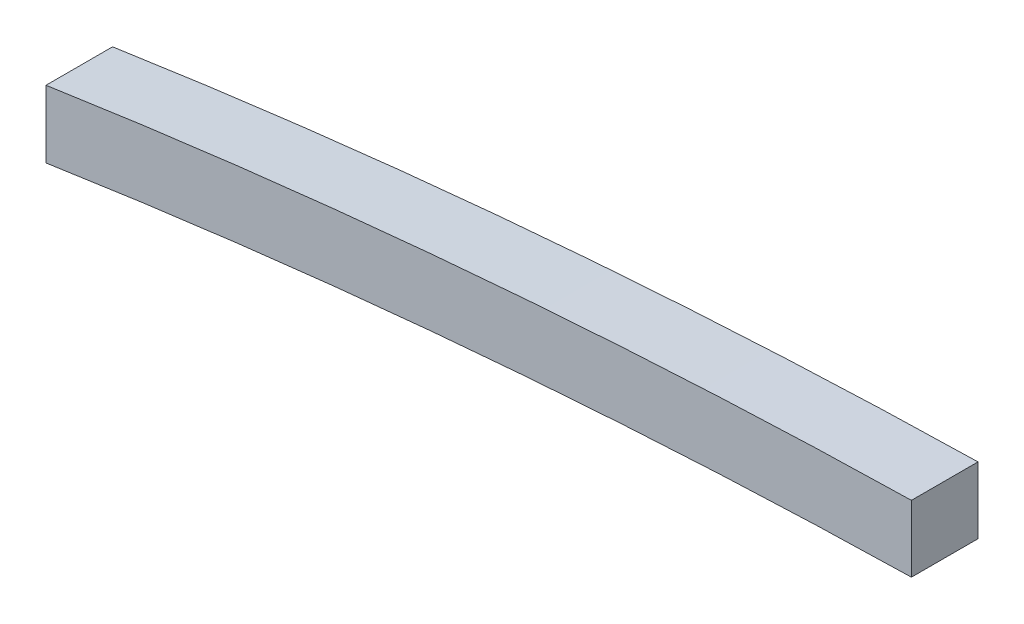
SolidWorks part; units mm, degrees
ref_plane "Ebene vorne" through (0, 0, 0) normal (0, 0, 1) x (1, 0, 0)
ref_plane "Ebene oben" through (0, 0, 0) normal (0, 1, 0) x (1, 0, 0)
ref_plane "Ebene rechts" through (0, 0, 0) normal (1, 0, 0) x (0, 0, -1)
sketch "Skizze1" plane through (0, 0, 0) normal (0, 0, 1) x (1, 0, 0)
  line L0 (0, 0) -> (0, 50.5664)
  line L1 (0, 0) -> (1500, 0) construction
  line L2 (750, 0) -> (750, -1054.9671) construction
  line L3 (49.4817, 57.7473) -> (49.4817, 57.7473)
  line L4 (1500, 0) -> (1500, 50.5664)
  line L5 (650, 105.5798) -> (650, 855.0296) construction
  line L6 (650, 105.5798) -> (650, 55.5699)
  arc A0 (1500, 0) -> (0, 0) centre (750, -4943.43) ccw
  arc A1 (1500, 50.5664) -> (0, 50.5664) centre (750, -4943.43) ccw
  arc A2 (1507.5, 49.4343) -> (49.4817, 57.7473) centre (750, -4943.43) ccw construction
  dimension "D2" = 5000
  dimension "D1" = 1500
  dimension "D4" = 650
  dimension "D3" = 50
extrude "Linear austragen1" add sketch "Skizze1" against normal blind 50
equation "\"LÄNGE\"=0"
equation "\"BREITE\"=0"
equation "\"HÖHE\"=0"
equation "\"DURCHMESSER\"=0"
equation "\"Stückzahl\"= 1"
